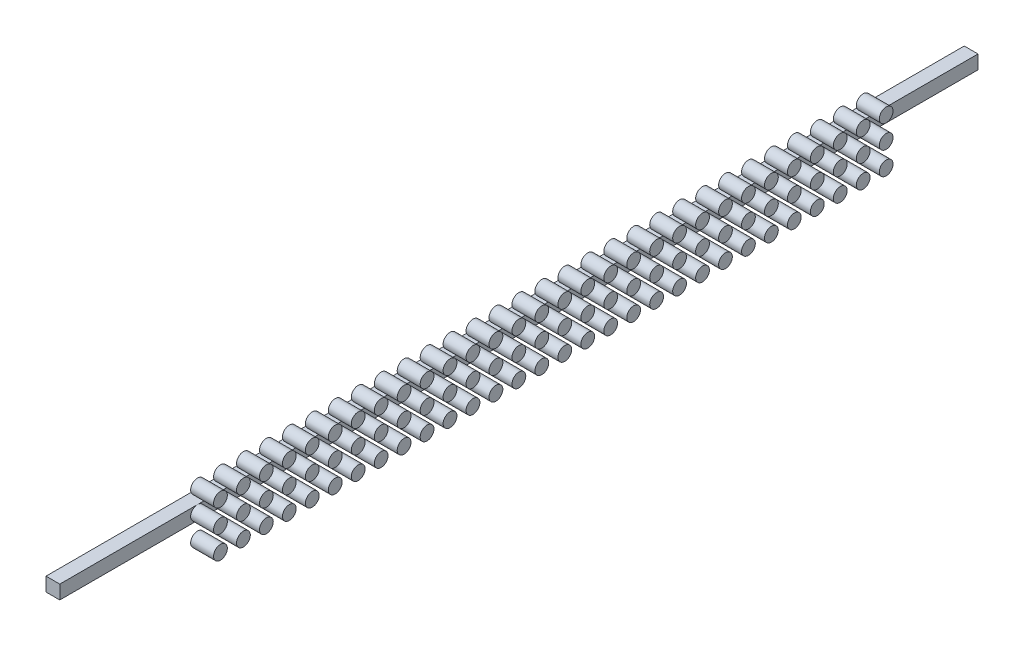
SolidWorks part; units mm, degrees
ref_plane "Front Plane" through (0, 0, 0) normal (1, 0, 0) x (0, 1, 0)
ref_plane "Top Plane" through (0, 0, 0) normal (0, 0, 1) x (0, 1, 0)
ref_plane "Right Plane" through (0, 0, 0) normal (0, 1, 0) x (-1, 0, 0)
sketch "Sketch1" plane through (0, 0, 0) normal (0, 0, 1) x (0, 1, 0)
  line L1 (-150, 150) -> (150, 150)
  line L2 (-150, 150) -> (-150, -150)
  line L3 (-150, -150) -> (150, -150)
  line L4 (150, 150) -> (150, -150)
  line L5 (-150, 150) -> (150, -150) construction
  line L6 (-150, -150) -> (150, 150) construction
  point P0 (0, 0)
  dimension "D1" = 300
  dimension "D2" = 300
extrude "Boss-Extrude1" add sketch "Sketch1" along normal blind 20000
ref_plane "Plane1" through (0, 0, 2500) normal (0, 0, 1) x (0, 1, 0)
sketch "Sketch2" plane through (150, 0, 0) normal (1, 0, 0) x (0, 1, 0)
  line L0 (440, 2500) -> (-440, 2500) construction
  line L1 (-500, 2500) -> (500, 2500) construction
  line L2 (0, -55) -> (0, 55) construction
  line L3 (-500, 3000) -> (500, 3000) construction
  line L4 (-500, 3500) -> (500, 3500) construction
  line L5 (-500, 4000) -> (500, 4000) construction
  line L6 (-500, 4500) -> (500, 4500) construction
  line L7 (-500, 5000) -> (500, 5000) construction
  line L8 (-500, 5500) -> (500, 5500) construction
  line L9 (-500, 6000) -> (500, 6000) construction
  line L10 (-500, 6500) -> (500, 6500) construction
  line L11 (-500, 7000) -> (500, 7000) construction
  line L12 (-500, 7500) -> (500, 7500) construction
  line L13 (-500, 8000) -> (500, 8000) construction
  line L14 (-500, 8500) -> (500, 8500) construction
  line L15 (-500, 9000) -> (500, 9000) construction
  line L16 (-500, 9500) -> (500, 9500) construction
  line L17 (-500, 10000) -> (500, 10000) construction
  line L18 (-500, 10500) -> (500, 10500) construction
  line L19 (-500, 11000) -> (500, 11000) construction
  line L20 (-500, 11500) -> (500, 11500) construction
  line L21 (-500, 12000) -> (500, 12000) construction
  line L22 (-500, 12500) -> (500, 12500) construction
  line L23 (-500, 13000) -> (500, 13000) construction
  line L24 (-500, 13500) -> (500, 13500) construction
  line L25 (-500, 14000) -> (500, 14000) construction
  line L26 (-500, 14500) -> (500, 14500) construction
  line L27 (-500, 15000) -> (500, 15000) construction
  line L28 (-500, 15500) -> (500, 15500) construction
  line L29 (-500, 16000) -> (500, 16000) construction
  line L30 (-500, 16500) -> (500, 16500) construction
  line L31 (-500, 17000) -> (500, 17000) construction
  circle A0 centre (-500, 2500) radius 150
  circle A2 centre (0, 2500) radius 150
  circle A3 centre (500, 2500) radius 150
  circle A4 centre (-500, 3000) radius 150
  circle A5 centre (0, 3000) radius 150
  circle A6 centre (500, 3000) radius 150
  circle A7 centre (-500, 3500) radius 150
  circle A8 centre (0, 3500) radius 150
  circle A9 centre (500, 3500) radius 150
  circle A10 centre (-500, 4000) radius 150
  circle A11 centre (0, 4000) radius 150
  circle A12 centre (500, 4000) radius 150
  circle A13 centre (-500, 4500) radius 150
  circle A14 centre (0, 4500) radius 150
  circle A15 centre (500, 4500) radius 150
  circle A16 centre (-500, 5000) radius 150
  circle A17 centre (0, 5000) radius 150
  circle A18 centre (500, 5000) radius 150
  circle A19 centre (-500, 5500) radius 150
  circle A20 centre (0, 5500) radius 150
  circle A21 centre (500, 5500) radius 150
  circle A22 centre (-500, 6000) radius 150
  circle A23 centre (0, 6000) radius 150
  circle A24 centre (500, 6000) radius 150
  circle A25 centre (-500, 6500) radius 150
  circle A26 centre (0, 6500) radius 150
  circle A27 centre (500, 6500) radius 150
  circle A28 centre (-500, 7000) radius 150
  circle A29 centre (0, 7000) radius 150
  circle A30 centre (500, 7000) radius 150
  circle A31 centre (-500, 7500) radius 150
  circle A32 centre (0, 7500) radius 150
  circle A33 centre (500, 7500) radius 150
  circle A34 centre (-500, 8000) radius 150
  circle A35 centre (0, 8000) radius 150
  circle A36 centre (500, 8000) radius 150
  circle A37 centre (-500, 8500) radius 150
  circle A38 centre (0, 8500) radius 150
  circle A39 centre (500, 8500) radius 150
  circle A40 centre (-500, 9000) radius 150
  circle A41 centre (0, 9000) radius 150
  circle A42 centre (500, 9000) radius 150
  circle A43 centre (-500, 9500) radius 150
  circle A44 centre (0, 9500) radius 150
  circle A45 centre (500, 9500) radius 150
  circle A46 centre (-500, 10000) radius 150
  circle A47 centre (0, 10000) radius 150
  circle A48 centre (500, 10000) radius 150
  circle A49 centre (-500, 10500) radius 150
  circle A50 centre (0, 10500) radius 150
  circle A51 centre (500, 10500) radius 150
  circle A52 centre (-500, 11000) radius 150
  circle A53 centre (0, 11000) radius 150
  circle A54 centre (500, 11000) radius 150
  circle A55 centre (-500, 11500) radius 150
  circle A56 centre (0, 11500) radius 150
  circle A57 centre (500, 11500) radius 150
  circle A58 centre (-500, 12000) radius 150
  circle A59 centre (0, 12000) radius 150
  circle A60 centre (500, 12000) radius 150
  circle A61 centre (-500, 12500) radius 150
  circle A62 centre (0, 12500) radius 150
  circle A63 centre (500, 12500) radius 150
  circle A64 centre (-500, 13000) radius 150
  circle A65 centre (0, 13000) radius 150
  circle A66 centre (500, 13000) radius 150
  circle A67 centre (-500, 13500) radius 150
  circle A68 centre (0, 13500) radius 150
  circle A69 centre (500, 13500) radius 150
  circle A70 centre (-500, 14000) radius 150
  circle A71 centre (0, 14000) radius 150
  circle A72 centre (500, 14000) radius 150
  circle A73 centre (-500, 14500) radius 150
  circle A74 centre (0, 14500) radius 150
  circle A75 centre (500, 14500) radius 150
  circle A76 centre (-500, 15000) radius 150
  circle A77 centre (0, 15000) radius 150
  circle A78 centre (500, 15000) radius 150
  circle A79 centre (-500, 15500) radius 150
  circle A80 centre (0, 15500) radius 150
  circle A81 centre (500, 15500) radius 150
  circle A82 centre (-500, 16000) radius 150
  circle A83 centre (0, 16000) radius 150
  circle A84 centre (500, 16000) radius 150
  circle A85 centre (-500, 16500) radius 150
  circle A86 centre (0, 16500) radius 150
  circle A87 centre (500, 16500) radius 150
  circle A88 centre (-500, 17000) radius 150
  circle A89 centre (0, 17000) radius 150
  circle A90 centre (500, 17000) radius 150
  point P6 (0, 2500)
  point P19 (0, 3000)
  point P26 (0, 3500)
  point P33 (0, 4000)
  point P40 (0, 4500)
  point P47 (0, 5000)
  point P54 (0, 5500)
  point P61 (0, 6000)
  point P68 (0, 6500)
  point P75 (0, 7000)
  point P82 (0, 7500)
  point P89 (0, 8000)
  point P96 (0, 8500)
  point P103 (0, 9000)
  point P110 (0, 9500)
  point P117 (0, 10000)
  point P124 (0, 10500)
  point P131 (0, 11000)
  point P138 (0, 11500)
  point P145 (0, 12000)
  point P152 (0, 12500)
  point P159 (0, 13000)
  point P166 (0, 13500)
  point P173 (0, 14000)
  point P180 (0, 14500)
  point P187 (0, 15000)
  point P194 (0, 15500)
  point P201 (0, 16000)
  point P208 (0, 16500)
  point P215 (0, 17000)
  dimension "D1" = 300
  dimension "D2" = 300
  dimension "D3" = 300
  dimension "D4" = 1000
  dimension "D5" = 30
extrude "Boss-Extrude2" add sketch "Sketch2" along normal blind 500
